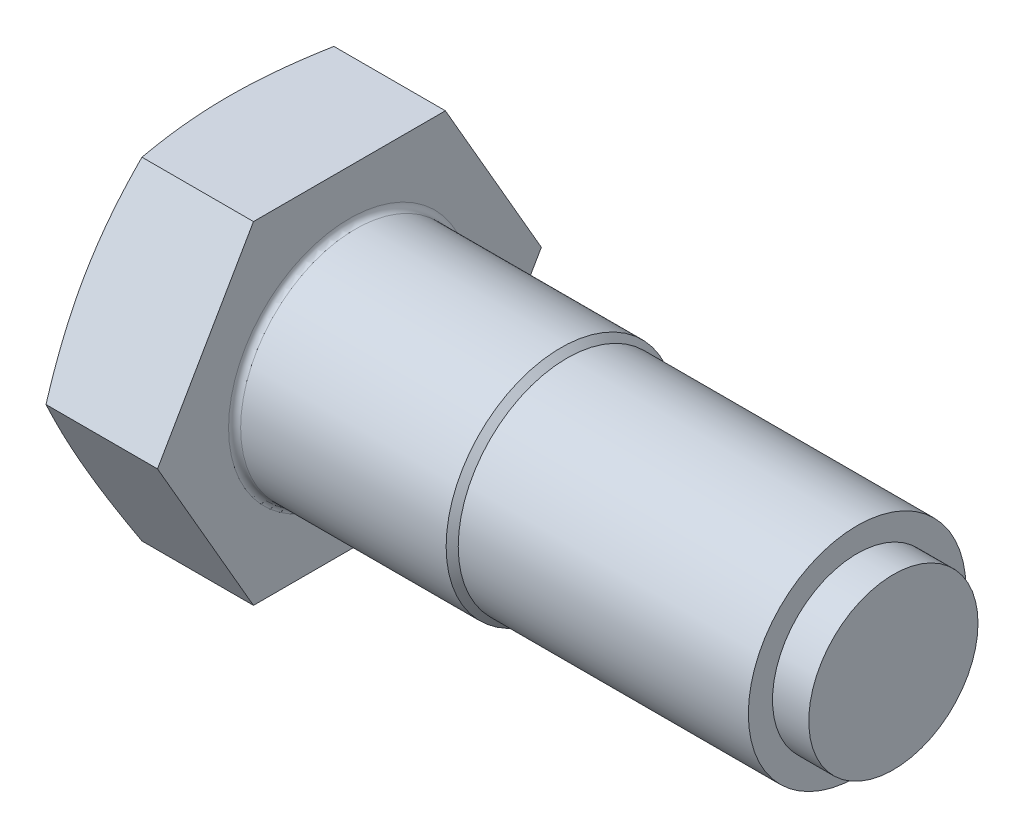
SolidWorks part; units mm, degrees
ref_plane "Front" through (0, 0, 0) normal (0, 0, 1) x (1, 0, 0)
ref_plane "Top" through (0, 0, 0) normal (0, 1, 0) x (1, 0, 0)
ref_plane "Right" through (0, 0, 0) normal (1, 0, 0) x (0, 0, -1)
sketch "Sketch1" plane through (0, 0, 0) normal (1, 0, 0) x (0, 0, -1)
  line L1 (31.7543, 0) -> (15.8771, 27.5)
  line L2 (15.8771, 27.5) -> (-15.8771, 27.5)
  line L3 (-15.8771, 27.5) -> (-31.7543, 0)
  line L4 (-31.7543, 0) -> (-15.8771, -27.5)
  line L5 (-15.8771, -27.5) -> (15.8771, -27.5)
  line L6 (15.8771, -27.5) -> (31.7543, 0)
  circle A0 centre (0, 0) radius 27.5 construction
  dimension "s" = 55
extrude "BaseHead" add sketch "Sketch1" along normal blind 20
sketch "Sketch2" plane through (20, 0, 0) normal (1, 0, 0) x (0, 0, -1)
  circle A0 centre (0, 0) radius 19
  dimension "ds" = 38
extrude "Basebody1" add sketch "Sketch2" along normal blind 35
sketch "Sketch4" plane through (55, 0, 0) normal (1, 0, 0) x (0, 0, -1)
  circle A0 centre (0, 0) radius 18
  dimension "d" = 36
extrude "Basebody2" add sketch "Sketch4" along normal offset from surface (55 mm away) 90
sketch "Sketch5" plane through (110, 0, 0) normal (1, 0, 0) x (0, 0, -1)
  circle A0 centre (0, 0) radius 14
  dimension "dp" = 28
extrude "Cut-Extrude1" cut sketch "Sketch5" against normal blind 6 flip side to cut
sketch "Sketch6" plane through (0, 0, 0) normal (0, 1, 0) x (1, 0, 0)
  line L0 (0, 31.7543) -> (1.5484, 31.7543)
  line L1 (1.5484, 31.7543) -> (0, 27.5)
  line L3 (0, 27.5) -> (0, 31.7543)
  line L4 (-1.5773, 0) -> (3.1205, 0) construction
  line L6 (20, 31.7543) -> (0, 31.7543) construction
  dimension "D1" = 20
  dimension "D2" = 55
revolve "HeadChamfer" cut sketch "Sketch6" angle 360 about L4
fillet "HeadFillet" radius 1 1 edges at (20, 0, 19)
chamfer "Chamfer1" distance 1 angle 45 1 edges at (55, 0, -18)
equation "\"D1@Chamfer1\" =  ( \"ds@Sketch2\" - \"d@Sketch4\" )  / 2"
equation "\"D2@Sketch6\" = \"s@Sketch1\""
